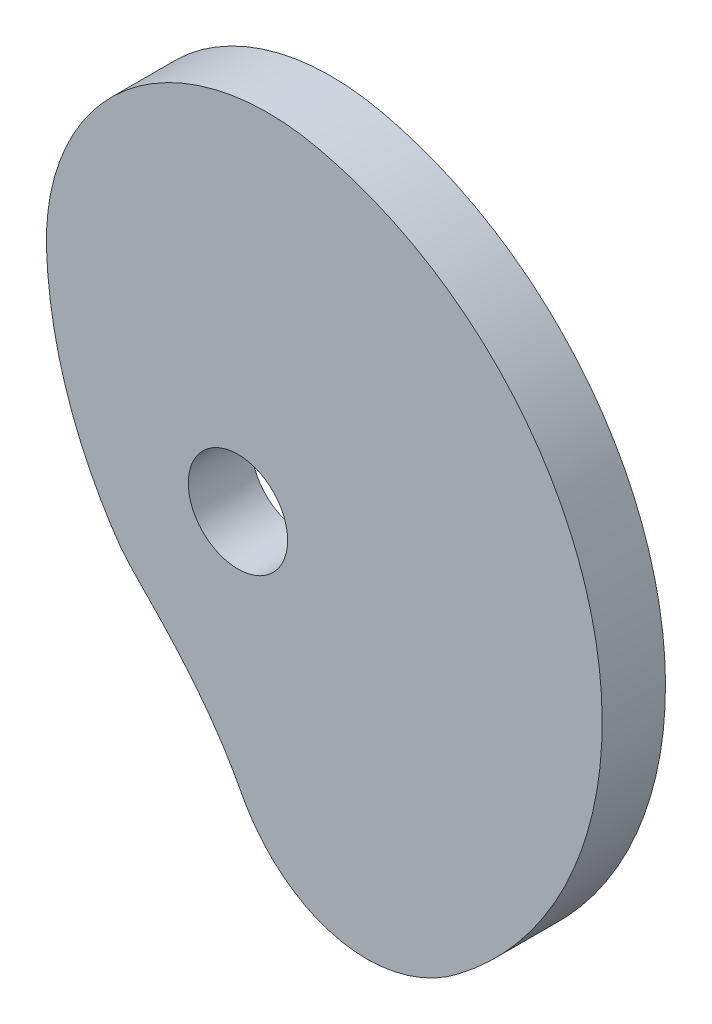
SolidWorks part; units mm, degrees
ref_plane "Face" through (0, 0, 0) normal (0, 0, 1) x (1, 0, 0)
ref_plane "Dessus" through (0, 0, 0) normal (0, 1, 0) x (1, 0, 0)
ref_plane "Droite" through (0, 0, 0) normal (1, 0, 0) x (0, 0, -1)
curve "Courbe1"
sketch "Esquisse1" plane through (0, 0, 0) normal (0, 0, 1) x (1, 0, 0)
  point P0 (-238.8, 419)
  dimension "D1" = 0
extrude "Extrusion1" add sketch "Esquisse1" along normal blind 20
sketch "Esquisse2" plane through (0, 0, 20) normal (0, 0, 1) x (1, 0, 0)
  circle A0 centre (-264.4628, 306.9928) radius 15.6981
extrude "Enlèv. mat.-Extru.1" cut sketch "Esquisse2" against normal up to next
